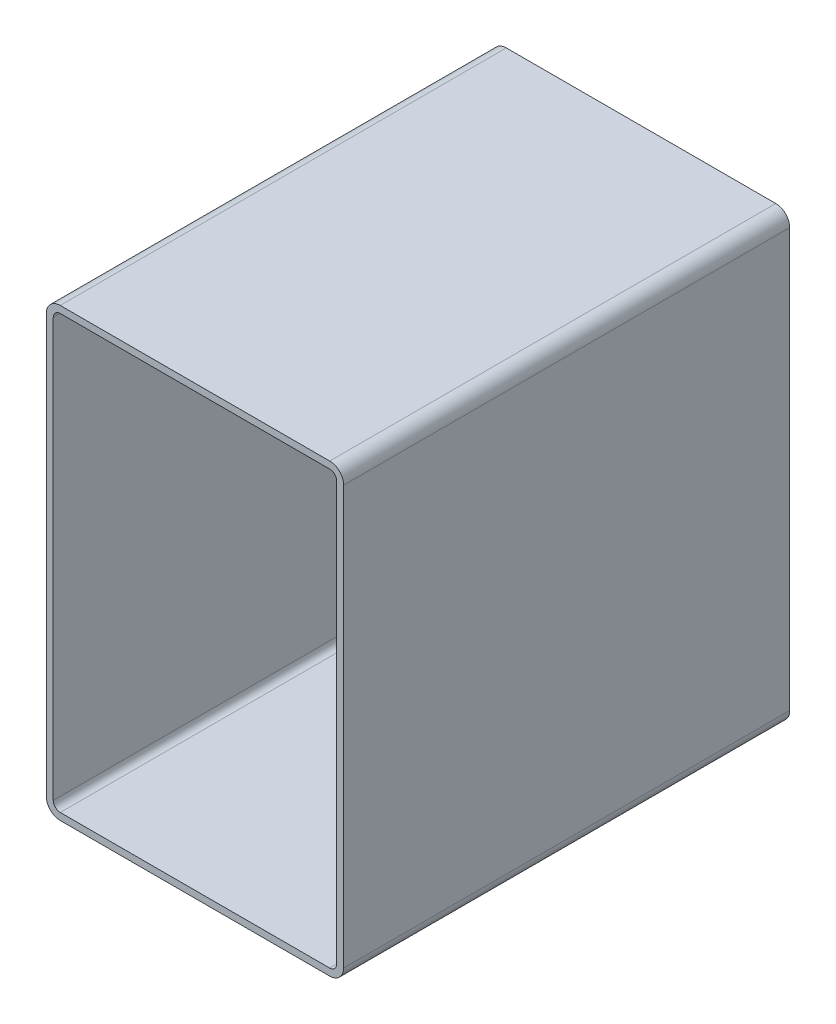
SolidWorks part; units mm, degrees
ref_plane "Front Plane" through (0, 0, 0) normal (0, 0, 1) x (1, 0, 0)
ref_plane "Top Plane" through (0, 0, 0) normal (0, 1, 0) x (1, 0, 0)
ref_plane "Right Plane" through (0, 0, 0) normal (1, 0, 0) x (0, 0, -1)
sketch "Sketch1" plane through (0, 0, 0) normal (0, 0, 1) x (1, 0, 0)
sketch_block_instance "HSS12x8x0.1875-1"
sketch_block "HSS12x8x0.1875"
extrude "Boss-Extrude1" add sketch "Sketch1" along normal blind 304.8
